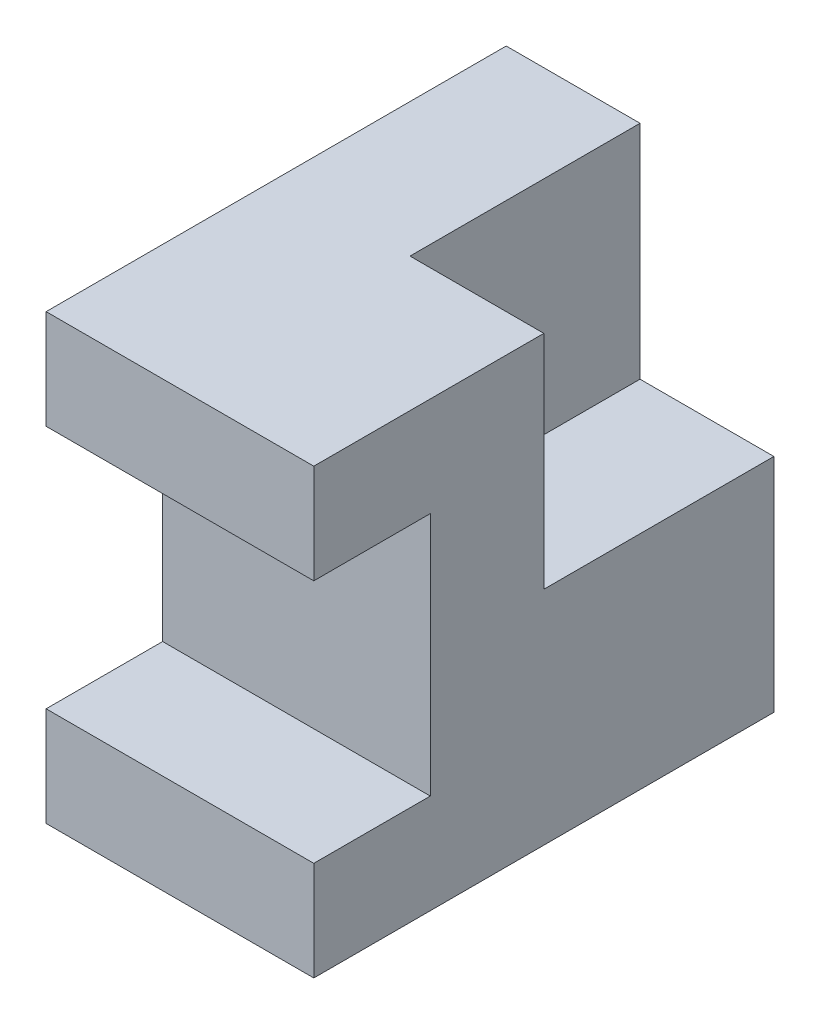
SolidWorks part; units mm, degrees
ref_plane "xy = von Vorne" through (0, 0, 0) normal (0, 0, 1) x (1, 0, 0)
ref_plane "zx = boden-parallel" through (0, 0, 0) normal (0, 1, 0) x (1, 0, 0)
ref_plane "yz = von Links" through (0, 0, 0) normal (1, 0, 0) x (0, 0, -1)
sketch "Skizze1" plane through (0, 0, 0) normal (1, 0, 0) x (0, 0, -1)
  line L0 (-13.0579, 13.7091) -> (-13.0579, 24.8404)
  line L1 (-13.0579, -24.8404) -> (38.5093, -24.8404)
  line L2 (-13.0579, -24.8404) -> (-13.0579, -13.7091)
  line L3 (-13.0579, 24.8404) -> (38.5093, 24.8404)
  line L4 (38.5093, -24.8404) -> (38.5093, 24.8404)
  line L5 (-13.0579, -13.7091) -> (0, -13.7091)
  line L6 (0, 0) -> (-25.8919, 0) construction
  line L7 (-13.0579, 13.7091) -> (0, 13.7091)
  line L8 (0, -13.7091) -> (0, 13.7091)
extrude "Aufsatz-Linear austragen1" add sketch "Skizze1" against normal blind 30
sketch "Skizze2" plane through (0, 0, 0) normal (0, 1, 0) x (1, 0, 0)
  line L0 (-30, 38.5093) -> (0, 38.5093) construction
  line L1 (15, 64.2929) -> (-15, 64.2929)
  line L2 (15, 64.2929) -> (15, 12.7257)
  line L3 (15, 12.7257) -> (-15, 12.7257)
  line L4 (-15, 64.2929) -> (-15, 12.7257)
  line L5 (0, 38.5093) -> (0, -13.0579) construction
  point P6 (-15, 38.5093)
  point P9 (0, 12.7257)
extrude "Schnitt-Linear austragen1" cut sketch "Skizze2" along normal through all
ref_plane "Ebene1" through (0, 0, -88.5093) normal (0, 0, -1) x (-1, 0, 0)
sketch "Skizze3" plane through (0, 0, -88.5093) normal (0, 0, -1) x (-1, 0, 0)
  line L0 (0, 13.7091) -> (0, 24.8404) construction
  line L1 (0, 24.8404) -> (30, 24.8404) construction
  line L2 (30, 24.8404) -> (30, 13.7091) construction
  line L3 (30, 13.7091) -> (0, 13.7091) construction
  line L4 (0, -13.7091) -> (0, 13.7091) construction
  line L5 (0, 13.7091) -> (30, 13.7091) construction
  line L6 (30, 13.7091) -> (30, -13.7091) construction
  line L7 (30, -13.7091) -> (0, -13.7091) construction
  line L8 (0, -24.8404) -> (0, -13.7091) construction
  line L9 (0, -13.7091) -> (30, -13.7091) construction
  line L10 (30, -13.7091) -> (30, -24.8404) construction
  line L11 (30, -24.8404) -> (0, -24.8404) construction
  line L12 (0, 13.7091) -> (0, 24.8404)
  line L13 (0, 24.8404) -> (30, 24.8404)
  line L14 (30, 24.8404) -> (30, 13.7091)
  line L15 (30, 13.7091) -> (0, 13.7091)
  line L16 (0, -13.7091) -> (0, 13.7091)
  line L17 (0, 13.7091) -> (30, 13.7091)
  line L18 (30, 13.7091) -> (30, -13.7091)
  line L19 (30, -13.7091) -> (0, -13.7091)
  line L20 (0, -24.8404) -> (0, -13.7091)
  line L21 (0, -13.7091) -> (30, -13.7091)
  line L22 (30, -13.7091) -> (30, -24.8404)
  line L23 (30, -24.8404) -> (0, -24.8404)
  line L28 (0, 13.7091) -> (0, -13.7091)
  line L29 (30, 13.7091) -> (0, 13.7091)
  line L30 (30, -13.7091) -> (30, 13.7091)
  line L31 (0, -13.7091) -> (30, -13.7091)
  line L32 (0, 13.7091) -> (0, -13.7091)
  line L33 (30, 13.7091) -> (0, 13.7091)
  line L34 (30, -13.7091) -> (30, 13.7091)
  line L35 (0, -13.7091) -> (30, -13.7091)
  dimension "D1" = 0
ref_plane "Ebene2" through (-80, 0, 0) normal (-1, 0, 0) x (0, 0, 1)
sketch "Skizze4" plane through (-80, 0, 0) normal (-1, 0, 0) x (0, 0, 1)
  line L1 (-12.7257, 24.8404) -> (13.0579, 24.8404) construction
  line L2 (13.0579, 24.8404) -> (13.0579, 13.7091) construction
  line L3 (13.0579, 13.7091) -> (0, 13.7091) construction
  line L4 (0, 13.7091) -> (0, -13.7091) construction
  line L5 (0, -13.7091) -> (13.0579, -13.7091) construction
  line L6 (13.0579, -13.7091) -> (13.0579, -24.8404) construction
  line L7 (13.0579, -24.8404) -> (-38.5093, -24.8404) construction
  line L8 (-38.5093, -24.8404) -> (-38.5093, 0) construction
  line L10 (-38.5093, 24.8404) -> (-12.7257, 24.8404) construction
  line L11 (-12.7257, 24.8404) -> (-12.7257, 0) construction
  line L12 (-12.7257, 0) -> (-38.5093, 0) construction
  line L13 (-38.5093, 0) -> (-38.5093, 24.8404) construction
  line L15 (-12.7257, 24.8404) -> (13.0579, 24.8404)
  line L16 (13.0579, 24.8404) -> (13.0579, 13.7091)
  line L17 (13.0579, 13.7091) -> (0, 13.7091)
  line L18 (0, 13.7091) -> (0, -13.7091)
  line L19 (0, -13.7091) -> (13.0579, -13.7091)
  line L20 (13.0579, -13.7091) -> (13.0579, -24.8404)
  line L21 (13.0579, -24.8404) -> (-38.5093, -24.8404)
  line L22 (-38.5093, -24.8404) -> (-38.5093, 0)
  line L24 (-38.5093, 24.8404) -> (-12.7257, 24.8404)
  line L25 (-12.7257, 24.8404) -> (-12.7257, 0)
  line L26 (-12.7257, 0) -> (-38.5093, 0)
  line L27 (-38.5093, 0) -> (-38.5093, 24.8404)
ref_plane "Ebene3" through (0, -74.8404, 0) normal (0, -1, 0) x (1, 0, 0)
sketch "Skizze5" plane through (0, -74.8404, 0) normal (0, -1, 0) x (1, 0, 0)
  line L0 (0, -38.5093) -> (0, -12.7257) construction
  line L1 (0, -38.5093) -> (-15, -38.5093) construction
  line L2 (0, -38.5093) -> (0, -12.7257)
  line L3 (0, -38.5093) -> (-15, -38.5093)
  line L6 (-15, -12.7257) -> (0, -12.7257)
  line L7 (-15, -38.5093) -> (-15, -12.7257)
  line L8 (-30, -38.5093) -> (-15, -38.5093)
  line L9 (-30, 13.0579) -> (-30, -38.5093)
  line L10 (0, 13.0579) -> (-30, 13.0579)
  line L11 (0, -12.7257) -> (0, 13.0579)
  line L12 (-15, -12.7257) -> (0, -12.7257)
  line L13 (-15, -38.5093) -> (-15, -12.7257)
  line L14 (-30, -38.5093) -> (-15, -38.5093)
  line L15 (-30, 13.0579) -> (-30, -38.5093)
  line L16 (0, 13.0579) -> (-30, 13.0579)
  line L17 (0, -12.7257) -> (0, 13.0579)
  dimension "D1" = 0
sketch3d "3D-Skizze1"
  line L0 (-15, 24.8404, -38.5093) -> (-15, 24.8404, -12.7257) construction
  line L1 (-15, 24.8404, -38.5093) -> (-15, 0, -38.5093) construction
  line L2 (-15, 24.8404, -38.5093) -> (-15, 24.8404, -12.7257)
  line L3 (-15, 24.8404, -38.5093) -> (-15, 0, -38.5093)
  line L4 (-30, 24.8404, 13.0579) -> (0, 24.8404, 13.0579) construction
  line L5 (-30, 24.8404, -38.5093) -> (-30, 24.8404, 13.0579) construction
  line L6 (-30, 24.8404, 13.0579) -> (0, 24.8404, 13.0579)
  line L7 (-30, 24.8404, -38.5093) -> (-30, 24.8404, 13.0579)
  line L8 (-30, 13.7091, 13.0579) -> (0, 13.7091, 13.0579) construction
  line L9 (-30, -13.7091, 13.0579) -> (0, -13.7091, 13.0579) construction
  line L10 (-30, -13.7091, 13.0579) -> (-30, -24.8404, 13.0579) construction
  line L11 (-30, 24.8404, 13.0579) -> (-30, 13.7091, 13.0579) construction
  line L12 (-30, 13.7091, 13.0579) -> (0, 13.7091, 13.0579)
  line L13 (-30, -13.7091, 13.0579) -> (0, -13.7091, 13.0579)
  line L14 (0, 0, -12.7257) -> (0, 24.8404, -12.7257)
  line L15 (0, 24.8404, -12.7257) -> (0, 24.8404, 13.0579)
  line L16 (0, 24.8404, 13.0579) -> (0, 13.7091, 13.0579)
  line L17 (0, 13.7091, 13.0579) -> (0, 13.7091, 0)
  line L18 (0, 13.7091, 0) -> (0, -13.7091, 0)
  line L19 (0, -13.7091, 0) -> (0, -13.7091, 13.0579)
  line L20 (0, -13.7091, 13.0579) -> (0, -24.8404, 13.0579)
  line L21 (0, -24.8404, 13.0579) -> (0, -24.8404, -38.5093)
  line L22 (0, -24.8404, -38.5093) -> (0, 0, -38.5093)
  line L23 (0, 0, -38.5093) -> (0, 0, -12.7257)
  line L24 (0, 0, -12.7257) -> (0, 24.8404, -12.7257)
  line L25 (0, 24.8404, -12.7257) -> (0, 24.8404, 13.0579)
  line L26 (0, 24.8404, 13.0579) -> (0, 13.7091, 13.0579)
  line L27 (0, 13.7091, 13.0579) -> (0, 13.7091, 0)
  line L28 (0, 13.7091, 0) -> (0, -13.7091, 0)
  line L29 (0, -13.7091, 0) -> (0, -13.7091, 13.0579)
  line L30 (0, -13.7091, 13.0579) -> (0, -24.8404, 13.0579)
  line L31 (0, -24.8404, 13.0579) -> (0, -24.8404, -38.5093)
  line L32 (0, -24.8404, -38.5093) -> (0, 0, -38.5093)
  line L33 (0, 0, -38.5093) -> (0, 0, -12.7257)
  line L34 (-30, -13.7091, 13.0579) -> (-30, -24.8404, 13.0579)
  line L35 (-30, 24.8404, 13.0579) -> (-30, 13.7091, 13.0579)
  line L36 (-30, -24.8404, 13.0579) -> (0, -24.8404, 13.0579) construction
  line L37 (-30, -24.8404, 13.0579) -> (0, -24.8404, 13.0579)
  line L38 (-30, 13.7091, 0) -> (-30, -13.7091, 0) construction
  line L39 (-30, 13.7091, 0) -> (-30, -13.7091, 0)
  line L40 (-30, -13.7091, 0) -> (0, -13.7091, 0) construction
  line L41 (-30, -13.7091, 0) -> (0, -13.7091, 0)
  line L42 (-30, 13.7091, 0) -> (0, 13.7091, 0) construction
  line L43 (-30, -13.7091, 0) -> (-30, -13.7091, 13.0579) construction
  line L44 (-30, 13.7091, 13.0579) -> (-30, 13.7091, 0) construction
  line L45 (-30, -13.7091, 0) -> (-30, -13.7091, 13.0579)
  line L46 (-30, 13.7091, 0) -> (0, 13.7091, 0)
  line L47 (-30, 13.7091, 13.0579) -> (-30, 13.7091, 0)
  line L48 (-30, 24.8404, -38.5093) -> (-15, 24.8404, -38.5093) construction
  line L49 (-30, 24.8404, -38.5093) -> (-15, 24.8404, -38.5093)
  line L50 (-30, 13.7091, -88.5093) -> (-30, -13.7091, -88.5093) construction
  line L51 (-30, -13.7091, -88.5093) -> (0, -13.7091, -88.5093) construction
  line L52 (0, -13.7091, -88.5093) -> (-30, -13.7091, -88.5093) construction
  line L53 (0, -24.8404, -88.5093) -> (0, -13.7091, -88.5093) construction
  line L54 (-30, -24.8404, -88.5093) -> (0, -24.8404, -88.5093) construction
  line L55 (-30, -13.7091, -88.5093) -> (-30, -24.8404, -88.5093) construction
  line L56 (-30, -13.7091, -88.5093) -> (-30, 13.7091, -88.5093) construction
  line L57 (0, -13.7091, -88.5093) -> (-30, -13.7091, -88.5093) construction
  line L58 (0, -13.7091, -88.5093) -> (0, 13.7091, -88.5093) construction
  line L59 (0, 13.7091, -88.5093) -> (0, -13.7091, -88.5093) construction
  line L60 (0, 13.7091, -88.5093) -> (0, 24.8404, -88.5093) construction
  line L61 (0, 24.8404, -88.5093) -> (-30, 24.8404, -88.5093) construction
  line L62 (-30, 24.8404, -88.5093) -> (-30, 13.7091, -88.5093) construction
  line L63 (-30, 13.7091, -88.5093) -> (0, 13.7091, -88.5093) construction
  line L64 (0, 13.7091, -88.5093) -> (-30, 13.7091, -88.5093) construction
  line L65 (-30, 13.7091, -88.5093) -> (0, 13.7091, -88.5093) construction
  line L66 (-30, 13.7091, -88.5093) -> (-30, -13.7091, -88.5093)
  line L67 (-30, -13.7091, -88.5093) -> (0, -13.7091, -88.5093)
  line L68 (0, -13.7091, -88.5093) -> (-30, -13.7091, -88.5093)
  line L69 (0, -24.8404, -88.5093) -> (0, -13.7091, -88.5093)
  line L70 (-30, -24.8404, -88.5093) -> (0, -24.8404, -88.5093)
  line L71 (-30, -13.7091, -88.5093) -> (-30, -24.8404, -88.5093)
  line L72 (-30, -13.7091, -88.5093) -> (-30, 13.7091, -88.5093)
  line L73 (0, -13.7091, -88.5093) -> (-30, -13.7091, -88.5093)
  line L74 (0, -13.7091, -88.5093) -> (0, 13.7091, -88.5093)
  line L75 (0, 13.7091, -88.5093) -> (0, -13.7091, -88.5093)
  line L76 (0, 13.7091, -88.5093) -> (0, 24.8404, -88.5093)
  line L77 (0, 24.8404, -88.5093) -> (-30, 24.8404, -88.5093)
  line L78 (-30, 24.8404, -88.5093) -> (-30, 13.7091, -88.5093)
  line L79 (-30, 13.7091, -88.5093) -> (0, 13.7091, -88.5093)
  line L80 (0, 13.7091, -88.5093) -> (-30, 13.7091, -88.5093)
  line L81 (-30, 13.7091, -88.5093) -> (0, 13.7091, -88.5093)
  line L82 (-80, 24.8404, -12.7257) -> (-80, 24.8404, 13.0579) construction
  line L83 (-80, 24.8404, 13.0579) -> (-80, 13.7091, 13.0579) construction
  line L84 (-80, 13.7091, 13.0579) -> (-80, 13.7091, 0) construction
  line L85 (-80, 13.7091, 0) -> (-80, -13.7091, 0) construction
  line L86 (-80, -13.7091, 0) -> (-80, -13.7091, 13.0579) construction
  line L87 (-80, -13.7091, 13.0579) -> (-80, -24.8404, 13.0579) construction
  line L88 (-80, -24.8404, 13.0579) -> (-80, -24.8404, -38.5093) construction
  line L89 (-80, -24.8404, -38.5093) -> (-80, 0, -38.5093) construction
  line L90 (-80, 24.8404, -12.7257) -> (-80, 0, -12.7257) construction
  line L91 (-80, 0, -12.7257) -> (-80, 0, -38.5093) construction
  line L92 (-80, 24.8404, -38.5093) -> (-80, 24.8404, -12.7257) construction
  line L93 (-80, 0, -38.5093) -> (-80, 24.8404, -38.5093) construction
  line L94 (-80, 24.8404, -12.7257) -> (-80, 24.8404, 13.0579)
  line L95 (-80, 24.8404, 13.0579) -> (-80, 13.7091, 13.0579)
  line L96 (-80, 13.7091, 13.0579) -> (-80, 13.7091, 0)
  line L97 (-80, 13.7091, 0) -> (-80, -13.7091, 0)
  line L98 (-80, -13.7091, 0) -> (-80, -13.7091, 13.0579)
  line L99 (-80, -13.7091, 13.0579) -> (-80, -24.8404, 13.0579)
  line L100 (-80, -24.8404, 13.0579) -> (-80, -24.8404, -38.5093)
  line L101 (-80, -24.8404, -38.5093) -> (-80, 0, -38.5093)
  line L102 (-80, 24.8404, -12.7257) -> (-80, 0, -12.7257)
  line L103 (-80, 0, -12.7257) -> (-80, 0, -38.5093)
  line L104 (-80, 24.8404, -38.5093) -> (-80, 24.8404, -12.7257)
  line L105 (-80, 0, -38.5093) -> (-80, 24.8404, -38.5093)
  line L106 (0, -74.8404, -38.5093) -> (0, -74.8404, -12.7257) construction
  line L107 (0, -74.8404, -38.5093) -> (-15, -74.8404, -38.5093) construction
  line L108 (-15, -74.8404, -12.7257) -> (0, -74.8404, -12.7257) construction
  line L109 (-15, -74.8404, -38.5093) -> (-15, -74.8404, -12.7257) construction
  line L110 (-30, -74.8404, -38.5093) -> (-15, -74.8404, -38.5093) construction
  line L111 (-30, -74.8404, 13.0579) -> (-30, -74.8404, -38.5093) construction
  line L112 (0, -74.8404, 13.0579) -> (-30, -74.8404, 13.0579) construction
  line L113 (0, -74.8404, -12.7257) -> (0, -74.8404, 13.0579) construction
  line L114 (0, -74.8404, -38.5093) -> (0, -74.8404, -12.7257)
  line L115 (0, -74.8404, -38.5093) -> (-15, -74.8404, -38.5093)
  line L116 (-15, -74.8404, -12.7257) -> (0, -74.8404, -12.7257)
  line L117 (-15, -74.8404, -38.5093) -> (-15, -74.8404, -12.7257)
  line L118 (-30, -74.8404, -38.5093) -> (-15, -74.8404, -38.5093)
  line L119 (-30, -74.8404, 13.0579) -> (-30, -74.8404, -38.5093)
  line L120 (0, -74.8404, 13.0579) -> (-30, -74.8404, 13.0579)
  line L121 (0, -74.8404, -12.7257) -> (0, -74.8404, 13.0579)
  dimension "D1" = 0
